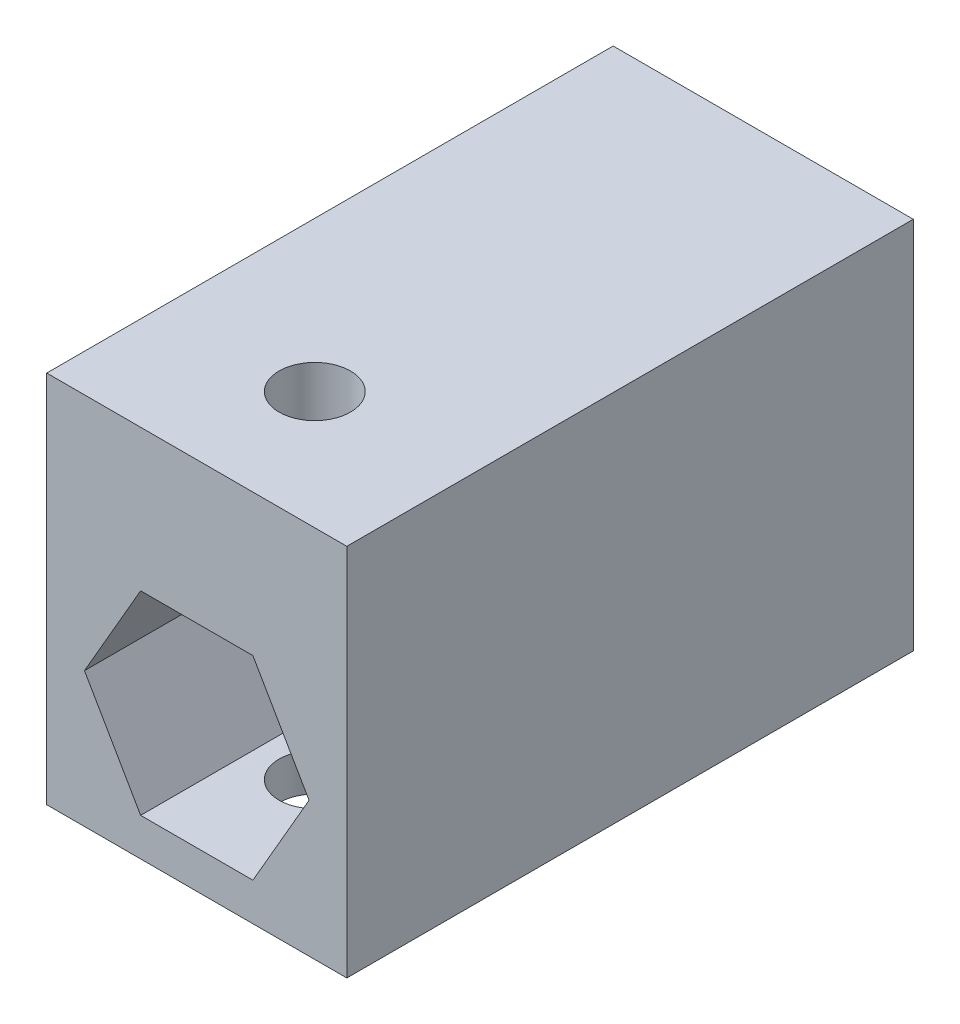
SolidWorks part; units mm, degrees
ref_plane "Front Plane" through (0, 0, 0) normal (0, 0, 1) x (1, 0, 0)
ref_plane "Top Plane" through (0, 0, 0) normal (0, 1, 0) x (1, 0, 0)
ref_plane "Right Plane" through (0, 0, 0) normal (1, 0, 0) x (0, 0, -1)
sketch "Sketch1" plane through (0, 0, 0) normal (0, 0, 1) x (1, 0, 0)
  line L1 (0, 0) -> (20.1846, 0)
  line L2 (0, 0) -> (0, 25.146)
  line L3 (0, 25.146) -> (20.1846, 25.146)
  line L4 (20.1846, 0) -> (20.1846, 25.146)
  line L5 (13.8685, 15.621) -> (6.3162, 15.621)
  line L6 (6.3162, 15.621) -> (2.54, 9.0805)
  line L7 (2.54, 9.0805) -> (6.3162, 2.54)
  line L8 (6.3162, 2.54) -> (13.8685, 2.54)
  line L9 (13.8685, 2.54) -> (17.6446, 9.0805)
  line L10 (17.6446, 9.0805) -> (13.8685, 15.621)
  circle A0 centre (10.0923, 9.0805) radius 6.5405 construction
  point P6 (10.0923, 15.621)
  point P14 (10.0923, 25.146)
  dimension "D1" = 9.525
  dimension "D2" = 13.081
  dimension "D3" = 2.54
  dimension "D4" = 2.54
extrude "Boss-Extrude1" add sketch "Sketch1" along normal blind 28.575
hole_wizard "#12 (0.189) Diameter Hole1" positions "Sketch2" profile "Sketch3" hole size "#12" standard "ANSI Inch"
sketch "Sketch2" plane through (0, 25.146, 0) normal (0, 1, 0) x (1, 0, 0)
  line L0 (20.1846, 0) -> (0, 0) construction
  point P0 (10.0923, -20.6375)
  point P5 (10.0923, 0)
  dimension "D1" = 20.6375
sketch "Sketch3" plane through (10.0923, 25.146, 20.6375) normal (1, 0, 0) x (0, 0, 1)
  line L0 (0, 0) -> (0, 25.146)
  line L1 (0, 25.146) -> (2.4003, 25.146)
  line L2 (2.4003, 25.146) -> (2.4003, 0)
  line L5 (2.4003, 0) -> (0, 0)
  line L11 (0, -6.35) -> (0, 107.95) construction
  dimension "Thru Hole Dia." = 4.8006
  dimension "Thru Hole Depth" = 25.146
sketch "Sketch4" plane through (0, 0, 0) normal (0, 0, -1) x (-1, 0, 0)
  line L2 (-6.3162, 2.54) -> (-13.8685, 2.54) construction
  line L3 (-20.1846, 0) -> (0, 0)
  line L4 (-20.1846, 0) -> (-20.1846, 25.146)
  line L5 (-20.1846, 25.146) -> (0, 25.146)
  line L6 (0, 0) -> (0, 25.146)
  circle A1 centre (-10.0923, 9.0805) radius 2.413
  point P14 (-10.0923, 2.54)
  dimension "D1" = 4.826
extrude "Boss-Extrude2" add sketch "Sketch4" along normal blind 9.525
